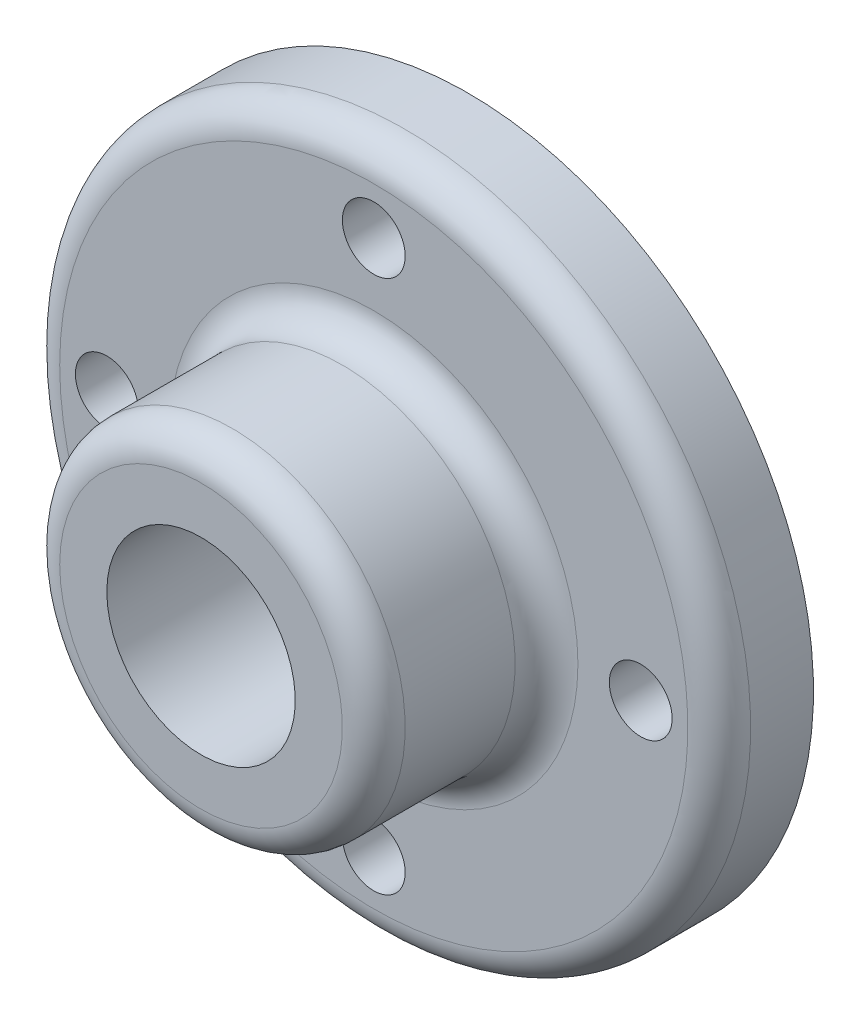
SolidWorks part; units mm, degrees
ref_plane "Front" through (0, 0, 0) normal (0, 0, 1) x (1, 0, 0)
ref_plane "Top" through (0, 0, 0) normal (0, 1, 0) x (1, 0, 0)
ref_plane "Right" through (0, 0, 0) normal (1, 0, 0) x (0, 0, -1)
sketch "Sketch1" plane through (0, 0, 0) normal (0, 1, 0) x (1, 0, 0)
  line L0 (0, 0) -> (0, -106.1197) construction
  line L1 (19.05, 0) -> (19.05, -53.975)
  line L2 (19.05, -53.975) -> (34.925, -53.975)
  line L3 (34.925, -53.975) -> (34.925, -19.05)
  line L4 (34.925, -19.05) -> (69.85, -19.05)
  line L5 (69.85, -19.05) -> (69.85, 0)
  line L6 (69.85, 0) -> (19.05, 0)
  dimension "D1" = 38.1
  dimension "D2" = 69.85
  dimension "D3" = 53.975
  dimension "D4" = 19.05
  dimension "D5" = 139.7
revolve "Base-Revolve" add sketch "Sketch1" angle 360 about L0
fillet "Fillet1" radius 6.35 3 edges at (-69.85, 0, 19.05) (-34.925, 0, 19.05) (-34.925, 0, 53.975)
sketch "Sketch2" plane through (0, 0, 0) normal (0, 0, -1) x (-1, 0, 0)
  circle A0 centre (0, 0) radius 53.975 construction
  circle A1 centre (-53.975, 0) radius 6.35
  dimension "D1" = 107.95
  dimension "D2" = 12.7
extrude "Cut-Extrude1" cut sketch "Sketch2" against normal through all
pattern_circular "CirPattern1" count 4 over 360 about axis through (0, 0, 0) along (0, 0, 1) of "Cut-Extrude1"
